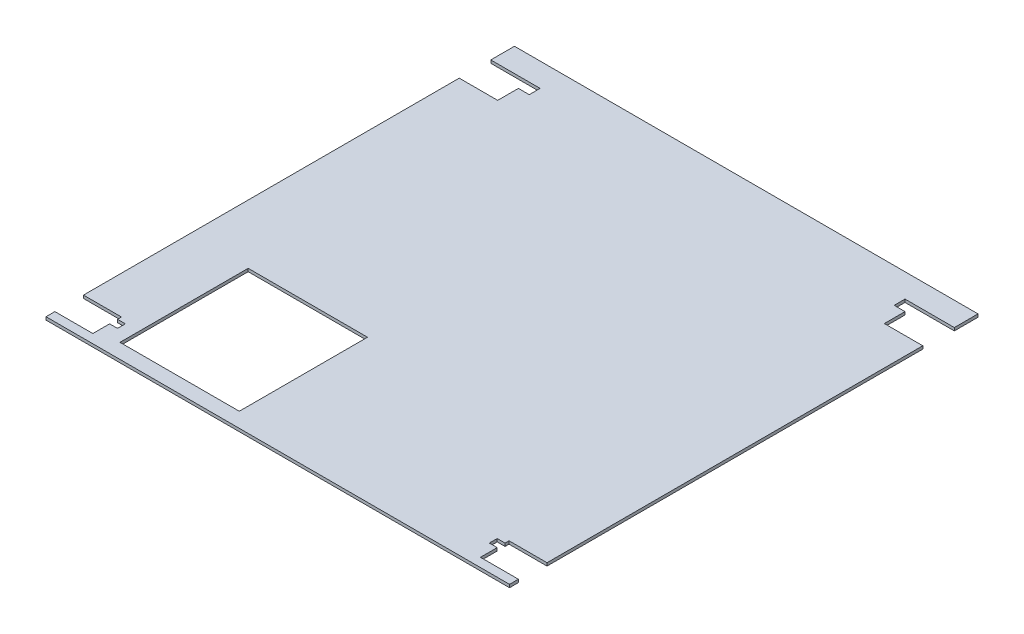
SolidWorks part; units mm, degrees
ref_plane "Alzado" through (0, 0, 0) normal (0, 0, 1) x (1, 0, 0)
ref_plane "Planta" through (0, 0, 0) normal (0, 1, 0) x (1, 0, 0)
ref_plane "Vista lateral" through (0, 0, 0) normal (1, 0, 0) x (0, 0, -1)
sketch "Sketch5" plane through (0, 0, 0) normal (0, 1, 0) x (1, 0, 0)
  line L1 (0, 0) -> (470, 0)
  line L2 (0, 0) -> (0, 475)
  line L3 (0, 475) -> (470, 475)
  line L4 (470, 0) -> (470, 475)
  dimension "D1" = 470
  dimension "D2" = 475
sketch "Sketch1" plane through (0, 0, 0) normal (0, 1, 0) x (1, 0, 0)
  line L5 (0, 451) -> (23, 451)
  line L7 (0, 419) -> (39, 419)
  line L8 (39, 440) -> (39, 419)
  line L9 (23, 451) -> (39, 451)
  line L24 (0, 9) -> (38.5, 9)
  line L26 (0, 38) -> (38.5, 38)
  line L27 (38.5, 9) -> (38.5, 26)
  line L28 (38.5, 34) -> (38.5, 38)
  line L29 (38.5, 34) -> (46.5, 34)
  line L31 (38.5, 26) -> (46.5, 26)
  line L32 (46.5, 34) -> (46.5, 26)
  line L33 (60, 15) -> (181, 15)
  line L34 (60, 15) -> (60, 145)
  line L35 (60, 145) -> (181, 145)
  line L36 (181, 15) -> (181, 145)
  line L37 (0, 419) -> (0, 451)
  line L38 (0, 9) -> (0, 38)
  line L40 (39, 451) -> (50, 451)
  line L42 (39, 440) -> (50, 440)
  line L43 (50, 451) -> (50, 440)
  point P10 (24.3899, 451)
  dimension "D2" = 381
  dimension "D3" = 32
  dimension "D4" = 60
  dimension "D5" = 9
  dimension "D8" = 15
  dimension "D9" = 38.5
  dimension "D10" = 29
  dimension "D12" = 8
  dimension "D13" = 8
  dimension "D14" = 4
  dimension "D15" = 121
  dimension "D16" = 130
extrude "Boss-Extrude4" add sketch "Sketch5" along normal blind 3
extrude "Cut-Extrude1" cut sketch "Sketch1" against normal through all both and the other way through all
sketch "Sketch7" plane through (0, 0, 0) normal (0, 1, 0) x (1, 0, 0)
  line L1 (60, 145) -> (181, 145)
  line L2 (60, 145) -> (60, 15)
  line L3 (60, 15) -> (181, 15)
  line L4 (181, 145) -> (181, 15)
extrude "Cut-Extrude2" cut sketch "Sketch7" against normal through all both and the other way through all
ref_plane "Plane1" through (235, 0, 0) normal (1, 0, 0) x (0, 0, -1)
mirror "Mirror1" about plane through (235, 0, 0) normal (1, 0, 0) of "Cut-Extrude1"
